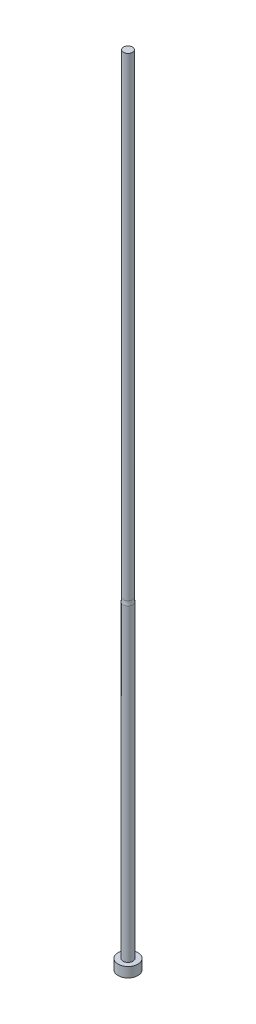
SolidWorks part; units mm, degrees
ref_plane "Front Plane" through (0, 0, 0) normal (0, 0, 1) x (1, 0, 0)
ref_plane "Top Plane" through (0, 0, 0) normal (0, 1, 0) x (1, 0, 0)
ref_plane "Right Plane" through (0, 0, 0) normal (1, 0, 0) x (0, 0, -1)
sketch "Sketch2" plane through (0, 0, 0) normal (0, 0, 1) x (1, 0, 0)
  line L0 (0, 0) -> (3.175, 0)
  line L1 (55, 0) -> (-55, 0) construction
  line L2 (3.175, 0) -> (3.175, 3.175)
  line L3 (3.175, 3.175) -> (1.5875, 3.175)
  line L4 (1.5875, 3.175) -> (1.5875, 101.6)
  line L5 (1.5875, 101.6) -> (1.4516, 101.6)
  line L6 (1.4516, 101.6) -> (1.4516, 254)
  line L7 (1.4516, 254) -> (0, 254)
  line L8 (0, 254) -> (0, 0)
  dimension "D1" = 3.175
  dimension "D2" = 3.175
  dimension "D3" = 1.5875
  dimension "D4" = 101.6
  dimension "D5" = 1.4516
  dimension "D6" = 254
revolve "Revolve1" add sketch "Sketch2" angle 360 about L8
fillet "Fillet1" radius 6.35 1 edges at (-1.4516, 101.6, 0)
